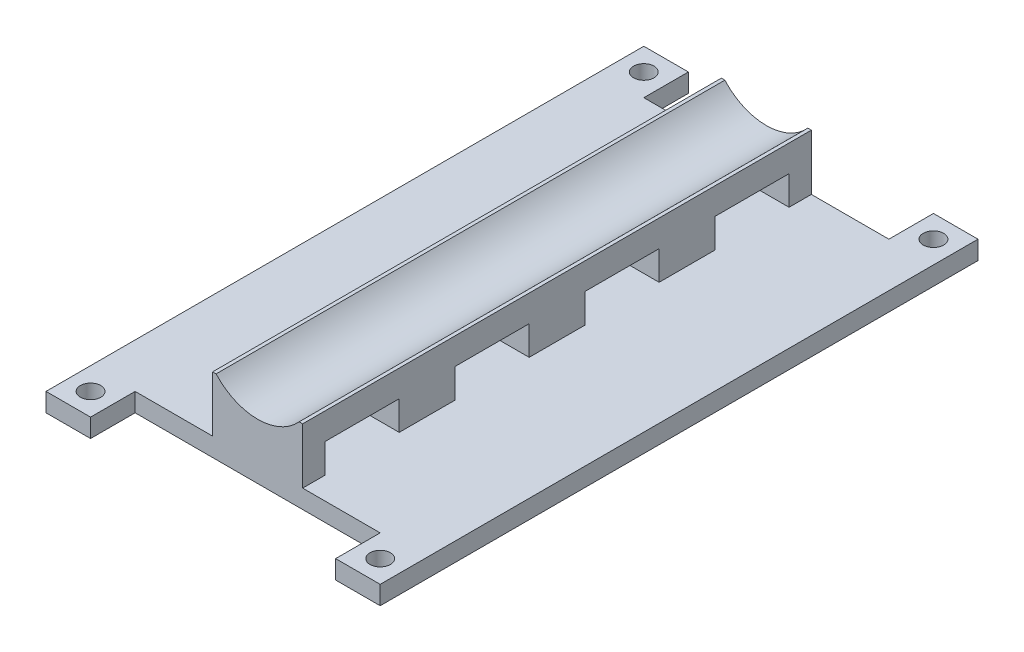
SolidWorks part; units mm, degrees
ref_plane "Front Plane" through (0, 0, 0) normal (0, 0, 1) x (1, 0, 0)
ref_plane "Top Plane" through (0, 0, 0) normal (0, 1, 0) x (1, 0, 0)
ref_plane "Right Plane" through (0, 0, 0) normal (1, 0, 0) x (0, 0, -1)
sketch "Sketch2" plane through (0, 0, 0) normal (0, 1, 0) x (1, 0, 0)
  line L0 (0, 0) -> (12, 0)
  line L1 (12, 0) -> (12, 12)
  line L2 (12, 12) -> (78, 12)
  line L3 (78, 12) -> (78, 0)
  line L4 (78, 0) -> (90, 0)
  line L5 (90, 0) -> (90, 161)
  line L6 (90, 161) -> (78, 161)
  line L7 (78, 161) -> (78, 149)
  line L8 (78, 149) -> (12, 149)
  line L9 (12, 149) -> (12, 161)
  line L10 (12, 161) -> (0, 161)
  line L11 (0, 161) -> (0, 0)
  circle A0 centre (6, 155) radius 2.75
  circle A1 centre (84, 155) radius 2.75
  circle A2 centre (84, 6) radius 2.75
  circle A3 centre (6, 6) radius 2.75
  dimension "D7" = 5.5
  dimension "D1" = 90
  dimension "D2" = 12
  dimension "D3" = 12
  dimension "D4" = 12
  dimension "D5" = 12
  dimension "D6" = 161
  dimension "D10" = 6
  dimension "D11" = 6
  dimension "D12" = 12
  dimension "D13" = 12
  dimension "D14" = 12
  dimension "D8" = 2
  dimension "D9" = 2
extrude "Boss-Extrude1" add sketch "Sketch2" along normal blind 5
sketch "Sketch3" plane through (0, 0, -12) normal (0, 0, 1) x (1, 0, 0)
  line L0 (12, 5) -> (78, 5) construction
  line L2 (32.8768, 5) -> (57.1232, 5)
  line L3 (32.8768, 5) -> (32.8768, 20)
  line L4 (32.8768, 20) -> (33.8197, 20)
  line L5 (57.1232, 5) -> (57.1232, 20)
  line L6 (56.1803, 20) -> (57.1232, 20)
  line L7 (90, 5) -> (90, 0) construction
  arc A0 (33.8197, 20) -> (56.1803, 20) centre (45, 30) ccw
  point P0 (45, 5)
  point P8 (45, 15)
  point P13 (45, 5)
  dimension "D1" = 25
  dimension "D2" = 10
  dimension "D3" = 45
  dimension "D4" = 45
  dimension "D5" = 15
extrude "Boss-Extrude2" add sketch "Sketch3" against normal blind 137
ref_plane "Plane1" through (45, 0, 0) normal (1, 0, 0) x (0, 0, -1)
sketch "Sketch5" plane through (45, 0, 0) normal (1, 0, 0) x (0, 0, -1)
  line L0 (12, 30) -> (150.2375, 30)
  line L1 (149, 5) -> (12, 5) construction
  dimension "D1" = 25
sketch "Sketch6" plane through (45, 0, 0) normal (1, 0, 0) x (0, 0, -1)
  line L0 (149, 5) -> (12, 5) construction
  line L1 (18, 5) -> (38, 5)
  line L2 (18, 5) -> (18, 9)
  line L3 (18, 9) -> (38, 9)
  line L4 (38, 5) -> (38, 9)
  line L5 (12, 5) -> (12, 20) construction
  dimension "D1" = 6
  dimension "D2" = 20
  dimension "D3" = 4
revolve "Cut-Revolve1" cut sketch "Sketch6" angle 360 about L0
sketch "Sketch7" plane through (57.1232, 0, 0) normal (1, 0, 0) x (0, 0, -1)
  line L0 (0, 5) -> (161, 5) construction
  line L1 (18, 8.1362) -> (38, 8.1362)
  line L2 (18, 8.1362) -> (18, 5)
  line L3 (18, 5) -> (38, 5)
  line L4 (38, 8.1362) -> (38, 5)
  line L5 (38, 12.8528) -> (38, 9) construction
  dimension "D1" = 0
extrude "Cut-Extrude1" cut sketch "Sketch7" against normal through all
pattern_linear "LPattern1" count 4 spacing 35 along (0, 0, -1) of "Cut-Revolve1", "Cut-Extrude1"
